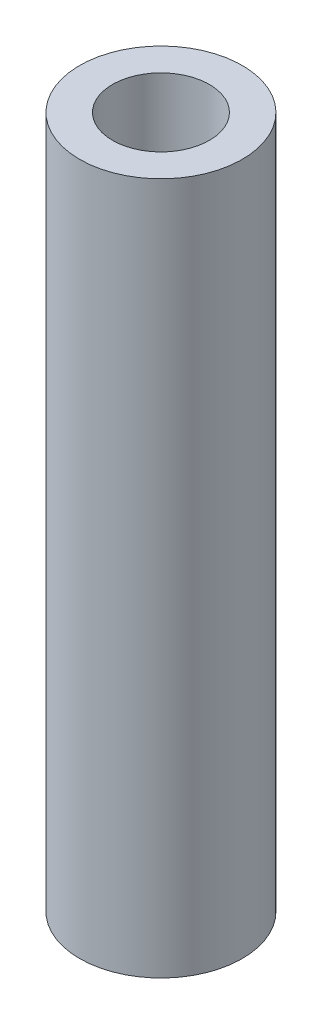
SolidWorks part; units mm, degrees
ref_plane "Front Plane" through (0, 0, 0) normal (0, 0, 1) x (1, 0, 0)
ref_plane "Top Plane" through (0, 0, 0) normal (0, 1, 0) x (1, 0, 0)
ref_plane "Right Plane" through (0, 0, 0) normal (1, 0, 0) x (0, 0, -1)
sketch "Sketch1" plane through (0, 0, 0) normal (0, 1, 0) x (1, 0, 0)
  circle A0 centre (0, 0) radius 2.3876
  dimension "D1" = 4.7752
extrude "Extrude1" add sketch "Sketch1" along normal blind 20.32
hole_wizard "#4-40 Tapped Hole1" positions "3DSketch1" profile "Sketch3" tap size "#4-40" standard "Ansi Inch"
sketch3d "3DSketch1"
  line L0 (0, 20.32, 0) -> (0, 0, 0) construction
  point P1 (0, 20.32, 0)
  point P5 (0, 0, 0)
sketch "Sketch3" plane through (0, 20.32, 0) normal (1, 0, 0) x (0, 0, 1)
  line L0 (0, 0) -> (0, 13.6332)
  line L1 (0, 13.6332) -> (1.1303, 12.954)
  line L2 (1.1303, 12.954) -> (1.1303, 9.652)
  line L3 (1.1303, 9.652) -> (1.4224, 9.652)
  line L4 (1.4224, 9.652) -> (1.4224, 0)
  line L5 (1.4224, 0) -> (0, 0)
  line L10 (0, 13.6332) -> (-1.1303, 12.954) construction
  line L11 (0, -6.35) -> (0, 107.95) construction
  dimension "Tap Drill Dia." = 2.2606
  dimension "Tap Drill Depth" = 12.954
  dimension "Thread Major Dia." = 2.8448
  dimension "Thread Depth" = 9.652
  dimension "Drill Angle" = 118
